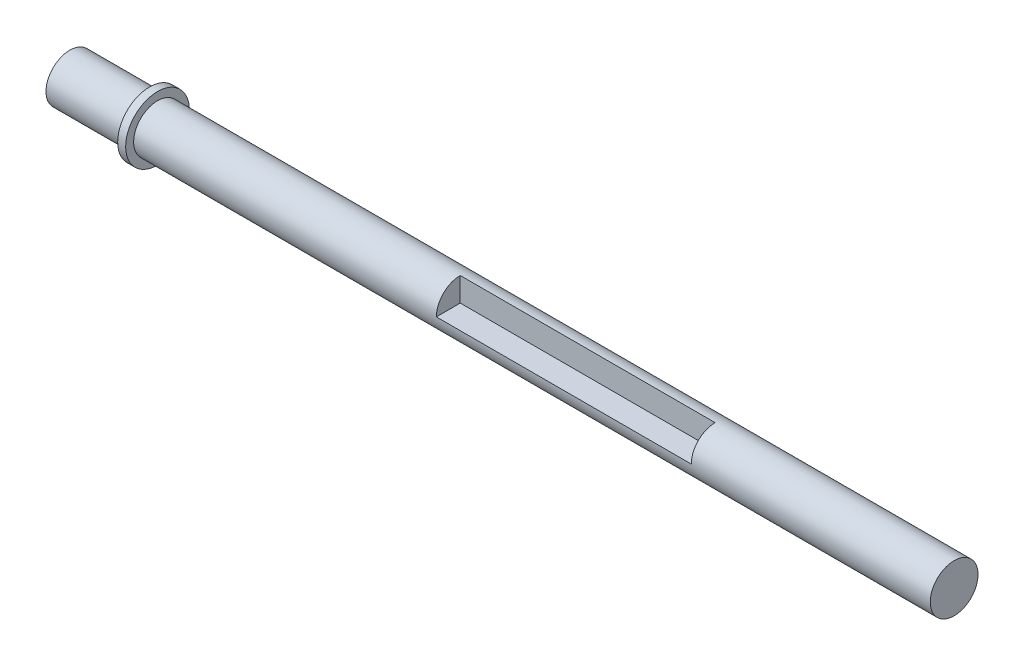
SolidWorks part; units mm, degrees
ref_plane "Face" through (0, 0, 0) normal (0, 0, 1) x (1, 0, 0)
ref_plane "Dessus" through (0, 0, 0) normal (0, 1, 0) x (1, 0, 0)
ref_plane "Droite" through (0, 0, 0) normal (1, 0, 0) x (0, 0, -1)
sketch "Esquisse1" plane through (0, 0, 0) normal (0, 0, 1) x (1, 0, 0)
  line L0 (0, 0) -> (56.582, 0) construction
  line L1 (0, 0) -> (0, 3)
  line L2 (0, 3) -> (10, 3)
  line L3 (10, 3) -> (10, 4)
  line L4 (10, 4) -> (11, 4)
  line L5 (11, 4) -> (11, 3)
  line L6 (11, 3) -> (111, 3)
  line L7 (111, 3) -> (111, 0)
  line L8 (0, 0) -> (111, 0)
  dimension "D1" = 10
  dimension "D2" = 100
  dimension "D3" = 1
  dimension "D4" = 3
  dimension "D5" = 4
revolve "Base-Révolution" add sketch "Esquisse1" angle 360 about L0
ref_plane "Plan1" through (81, 0, 0) normal (1, 0, 0) x (0, 0, -1)
sketch "Esquisse2" plane through (81, 0, 0) normal (1, 0, 0) x (0, 0, -1)
  line L0 (0, 0) -> (0, 3)
  line L1 (0, 0) -> (-3, 0)
  circle A0 centre (0, 0) radius 3 construction
  arc A1 (0, 3) -> (-3, 0) centre (0, 0) ccw
extrude "Enlèv. mat.-Extru.1" cut sketch "Esquisse2" against normal blind 32
